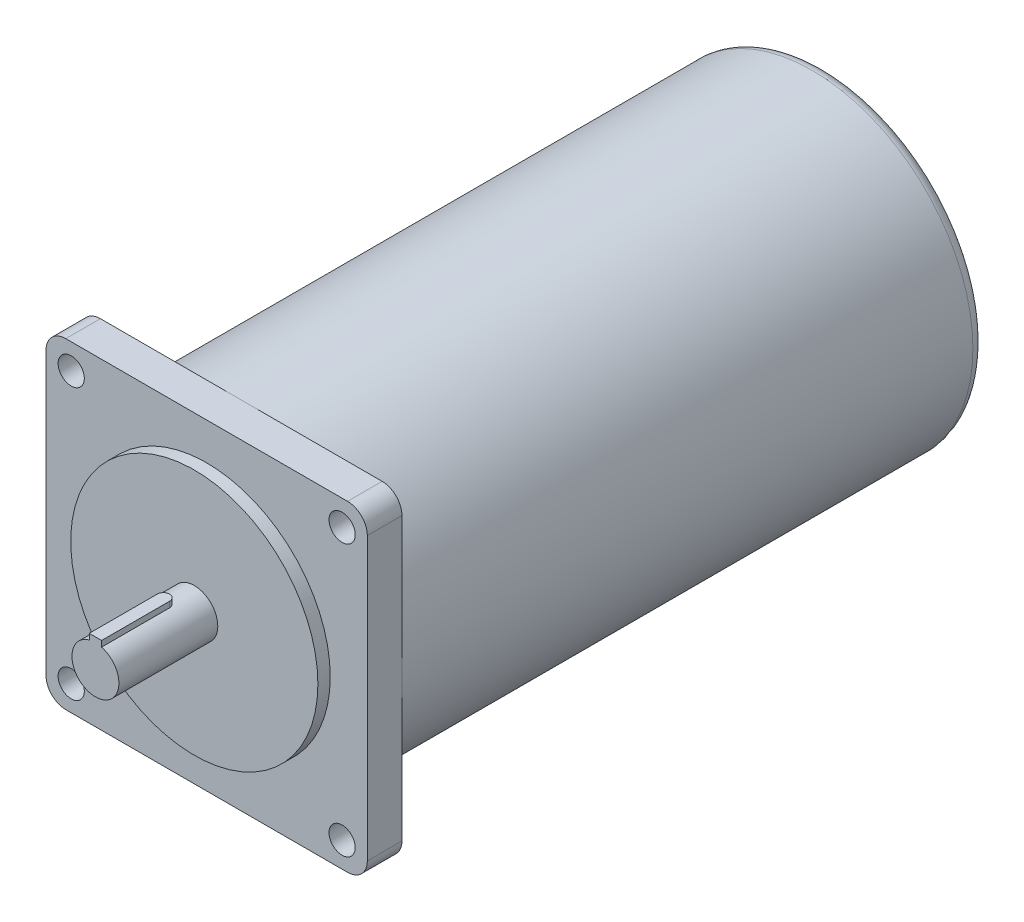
SolidWorks part; units mm, degrees
ref_plane "前视基准面" through (0, 0, 0) normal (0, 0, 1) x (1, 0, 0)
ref_plane "上视基准面" through (0, 0, 0) normal (0, 1, 0) x (1, 0, 0)
ref_plane "右视基准面" through (0, 0, 0) normal (1, 0, 0) x (0, 0, -1)
sketch "草图1" plane through (0, 0, 0) normal (0, 0, 1) x (1, 0, 0)
  circle A0 centre (0, 0) radius 50
extrude "凸台-拉伸1" add sketch "草图1" against normal blind 5
sketch "草图2" plane through (0, 0, 0) normal (0, 0, 1) x (1, 0, 0)
  circle A0 centre (0, 0) radius 9.5
extrude "凸台-拉伸2" add sketch "草图2" along normal blind 40
sketch "草图3" plane through (0, 0, 0) normal (0, 1, 0) x (1, 0, 0)
  line L1 (-9.5, -40) -> (9.5, -40) construction
  line L2 (-2.5, -12.5) -> (-2.5, -40)
  line L3 (-2.5, -40) -> (2.5, -40)
  line L4 (2.5, -40) -> (2.5, -12.5)
  arc A0 (2.5, -12.5) -> (-2.5, -12.5) centre (0, -12.5) ccw
extrude "凸台-拉伸3" add sketch "草图3" along normal blind 11.5
sketch "草图4" plane through (0, 0, -5) normal (0, 0, -1) x (-1, 0, 0)
  line L1 (0, 65) -> (57, 65)
  line L2 (65, 57) -> (65, -57)
  line L3 (57, -65) -> (-57, -65)
  line L4 (-65, -57) -> (-65, 57)
  line L5 (-57, 65) -> (0, 65)
  arc A0 (-57, -65) -> (-65, -57) centre (-57, -57) cw
  arc A1 (65, -57) -> (57, -65) centre (57, -57) cw
  arc A2 (57, 65) -> (65, 57) centre (57, 57) cw
  arc A3 (-65, 57) -> (-57, 65) centre (-57, 57) cw
  circle A4 centre (-54.8, 54.8) radius 5.3
  circle A5 centre (54.8, 54.8) radius 5.3
  circle A6 centre (54.8, -54.8) radius 5.3
  circle A7 centre (-54.8, -54.8) radius 5.3
  dimension "D1" = 8
extrude "凸台-拉伸4" add sketch "草图4" along normal blind 14
sketch "草图6" plane through (0, 0, -19) normal (0, 0, -1) x (-1, 0, 0)
  circle A0 centre (0, 0) radius 65
extrude "凸台-拉伸5" add sketch "草图6" along normal blind 236
fillet "圆角1" radius 5 1 edges at (-65, 0, -255)
